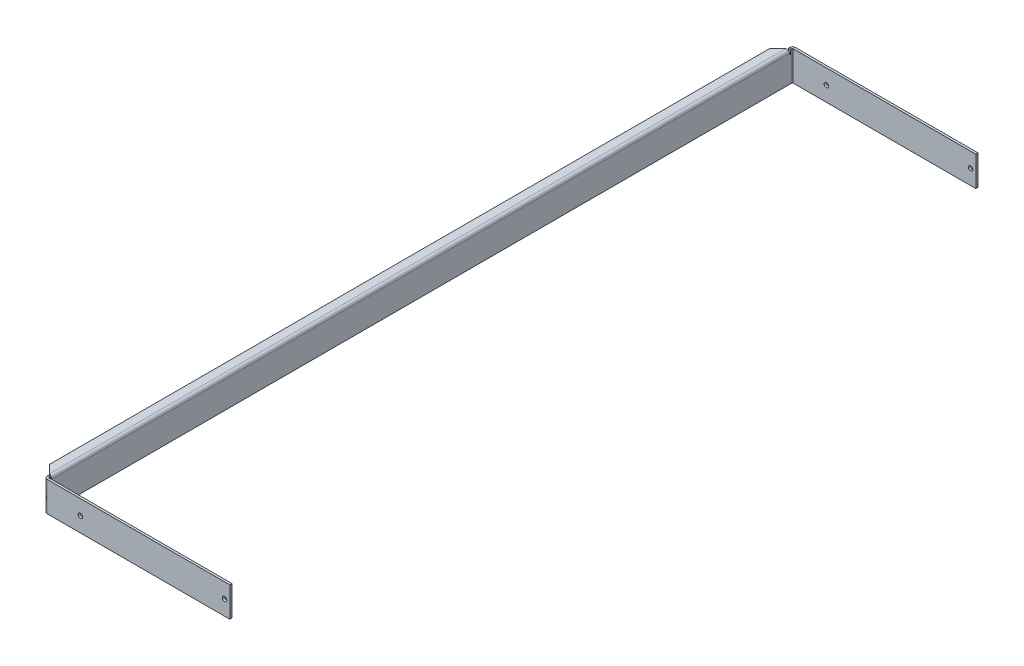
SolidWorks part; units mm, degrees
ref_plane "Plan1" through (0, 0, 0) normal (0, 0, 1) x (1, 0, 0)
ref_plane "Plan2" through (0, 0, 0) normal (0, 1, 0) x (1, 0, 0)
ref_plane "Plan3" through (0, 0, 0) normal (1, 0, 0) x (0, 0, -1)
sketch "Esquisse1" plane through (0, 0, 0) normal (0, 0, 1) x (1, 0, 0)
  line L0 (0, 0) -> (-3, 0)
  line L1 (0, 0) -> (0, 40)
  line L3 (-3, 37) -> (-3, 0)
  line L4 (0, 40) -> (-15, 40)
  line L6 (-15, 37) -> (-3, 37)
  line L7 (-15, 37) -> (-15, 40)
  dimension "D1" = 15
  dimension "D2" = 40
  dimension "D3" = 3
  dimension "D4" = 3
extrude "Base-Extrusion" add sketch "Esquisse1" along normal mid plane 998
sketch "Esquisse2" plane through (0, 0, 0) normal (1, 0, 0) x (0, 0, -1)
  line L0 (-499, 40) -> (-502, 40)
  line L1 (-499, 40) -> (-499, 0)
  line L2 (-502, 0) -> (-499, 0)
  line L3 (-502, 0) -> (-502, 40)
  line L4 (-499, 0) -> (499, 0) construction
  dimension "D1" = 3
extrude "Boss.-Extru.2" add sketch "Esquisse2" along normal blind 246 and the other way up to surface
sketch "Esquisse7" plane through (0, 40, 0) normal (0, 1, 0) x (-1, 0, 0)
  line L0 (-60.702, 0) -> (60.702, 0) construction
  line L1 (0, -499) -> (15, -499) construction
  line L2 (15, -499) -> (3, -499)
  line L3 (15, -499) -> (15, -497)
  line L4 (15, -497) -> (3, -497)
  line L5 (3, -499) -> (3, -497)
  line L6 (15, 499) -> (15, -499) construction
  line L7 (3, 499) -> (3, 502) construction
  line L8 (3, 499) -> (3, 497)
  line L9 (15, 497) -> (3, 497)
  line L10 (15, 499) -> (15, 497)
  line L11 (15, 499) -> (3, 499)
  dimension "D1" = 2
extrude "Enlèv. mat.-Extru.2" cut sketch "Esquisse7" against normal through all
sketch "Esquisse10" plane through (0, 40, 0) normal (0, 1, 0) x (-1, 0, 0)
  line L0 (-61.2422, 0) -> (61.2422, 0) construction
  line L1 (3, 495) -> (15, 483)
  line L2 (3, 497) -> (15, 497)
  line L3 (3, 497) -> (3, 495)
  line L4 (15, -497) -> (15, -483)
  line L5 (15, 497) -> (15, 483)
  line L6 (3, 497) -> (15, 497) construction
  line L8 (15, 497) -> (15, -497) construction
  line L9 (3, 502) -> (3, 497) construction
  line L11 (3, -497) -> (3, -495)
  line L12 (3, -497) -> (15, -497)
  line L13 (3, -495) -> (15, -483)
  dimension "D1" = 135
  dimension "D2" = 2
extrude "Enlèv. mat.-Extru.3" cut sketch "Esquisse10" against normal through all
mirror "Symétrie1" about plane through (0, 0, 0) normal (0, 0, 1)
sketch "Esquisse6" plane through (0, 0, 502) normal (0, 0, 1) x (1, 0, 0)
  line L0 (246, 0) -> (246, 40) construction
  line L1 (246, 0) -> (-3, 0) construction
  circle A0 centre (239, 20) radius 3
  circle A1 centre (45.5, 20) radius 3
  dimension "D2" = 6
  dimension "D1" = 7
  dimension "D3" = 20
  dimension "D4" = 193.5
extrude "Enlèv. mat.-Extru.1" cut sketch "Esquisse6" against normal through all
sheet metal parameters "Tôlerie 2" parameters "D1"=1, "Epaisseur"=3
bend "Pli dans angle6" parameters "D1"=0
flatten bends "Dépliage 2" parameters "D1"=0, "D4"=90, "D5"=1
sketch "Esquisse-Angle2" plane through (0, 0, 0) normal (1, 0, 0) x (0, 0, -1)
  line L0 (-495, 37) -> (495, 37) construction
  line L1 (-499, 40) -> (-499, 0) construction
  line L2 (499, 0) -> (499, 40) construction
bend "Pli dans angle5" bend angle 90 parameters "D1"=0, "D5"=2
bend "Pli dans angle7" bend angle 90 parameters "D1"=0, "D5"=3
process bends "Pliage 2" parameters "D1"=0
sketch "Esquisse-Plate2" plane through (0, 0, 0) normal (1, 0, 0) x (0, 0, -1)
